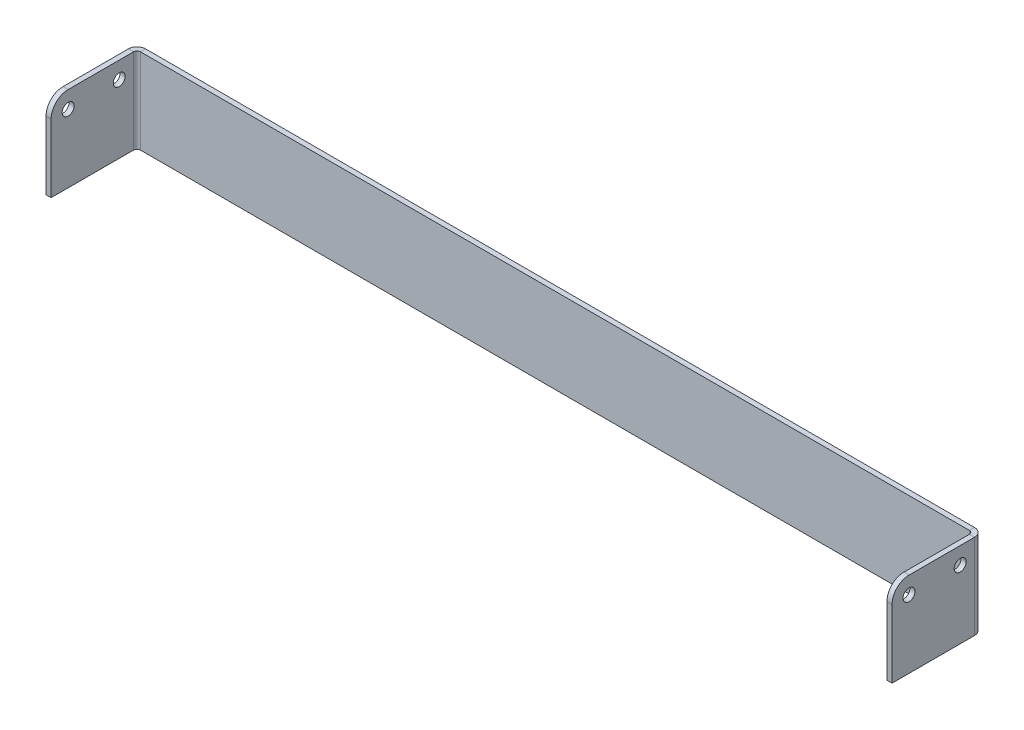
SolidWorks part; units mm, degrees
ref_plane "Front Plane" through (0, 0, 0) normal (0, 0, 1) x (1, 0, 0)
ref_plane "Top Plane" through (0, 0, 0) normal (0, 1, 0) x (1, 0, 0)
ref_plane "Right Plane" through (0, 0, 0) normal (1, 0, 0) x (0, 0, -1)
sketch "Sketch1" plane through (0, 0, 0) normal (0, 0, 1) x (1, 0, 0)
  line L0 (5, 20) -> (20, 20) construction
  line L1 (0, 0) -> (295, 0)
  line L2 (0, 0) -> (0, 20)
  line L3 (5, 25) -> (290, 25)
  line L4 (295, 0) -> (295, 20)
  line L5 (290, 20) -> (275, 20) construction
  arc A0 (295, 20) -> (290, 25) centre (290, 20) ccw
  arc A1 (0, 20) -> (5, 25) centre (5, 20) cw
  circle A2 centre (290, 20) radius 1.75
  circle A3 centre (275, 20) radius 1.75
  circle A4 centre (5, 20) radius 1.75
  circle A5 centre (20, 20) radius 1.75
  point P7 (295, 25)
  point P10 (0, 25)
  dimension "D3" = 5
  dimension "D4" = 3.5
  dimension "D5" = 15
  dimension "D6" = 15
  dimension "D1" = 295
  dimension "D2" = 25
sheet metal parameters "Sheet-Metal1" thickness 1.5 parameters "D1"=1
base flange "Base-Flange1" sketch "Sketch1" thickness 1.5 reverse thickness direction yes parameters "D1"=1
sketch "Sketch3" plane through (0, 0, 1.5) normal (0, 0, 1) x (1, 0, 0)
  line L0 (25, 25) -> (25, 0)
  line L1 (290, 25) -> (5, 25) construction
  line L2 (0, 0) -> (295, 0) construction
  line L3 (270, 25) -> (270, 0)
  line L4 (295, 0) -> (295, 20) construction
  line L5 (0, 20) -> (0, 0) construction
  point P10 (0, 10)
  dimension "D1" = 25
  dimension "D2" = 25
sketched bend "Sketched Bend1" parameters "D1"=0
bend "SketchBend1" bend radius 1 bend angle 90 parameters "D5"=1
bend "SketchBend2" bend radius 0 bend angle 90 parameters "D5"=2
flat pattern "Flat-Pattern1"
sketch "Bend-Lines1" plane through (0, 0, 0) normal (0, 1, 0) x (-1, 0, 0)
bend of the flat pattern "Flatten-<SketchBend1>1"
bend of the flat pattern "Flatten-<SketchBend2>1"
